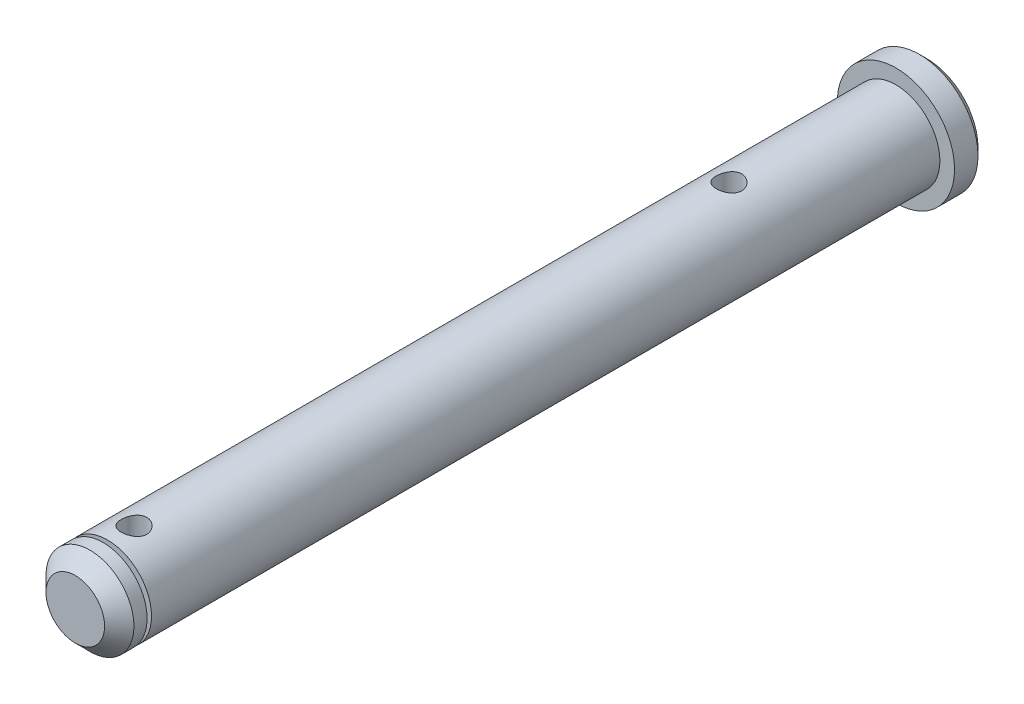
SolidWorks part; units mm, degrees
ref_plane "正面" through (0, 0, 0) normal (0, 0, 1) x (1, 0, 0)
ref_plane "平面" through (0, 0, 0) normal (0, 1, 0) x (1, 0, 0)
ref_plane "右側面" through (0, 0, 0) normal (1, 0, 0) x (0, 0, -1)
sketch "ｽｹｯﾁ1" plane through (0, 0, 0) normal (0, 0, 1) x (1, 0, 0)
  circle A0 centre (0, 0) radius 4
  dimension "D1" = 8
extrude "ﾎﾞｽ - 押し出し1" add sketch "ｽｹｯﾁ1" along normal blind 2.1
sketch "ｽｹｯﾁ2" plane through (0, 0, 0) normal (0, 0, -1) x (-1, 0, 0)
  circle A0 centre (0, 0) radius 3
  dimension "D1" = 6
extrude "ﾎﾞｽ - 押し出し2" add sketch "ｽｹｯﾁ2" against normal blind 58.1
hole_wizard "Ø1.75 (1.75) 直径の穴1" positions "3Dｽｹｯﾁ1" profile "ｽｹｯﾁ3" hole size "Ø1.75" standard "JIS"
sketch3d "3Dｽｹｯﾁ1"
  line L0 (0, 0, 0) -> (0, 3, 0) construction
  line L2 (0, 3, 0) -> (0, 3, 58.1) construction
  circle A0 centre (0, 0, 58.1) radius 3 construction
  point P0 (0, 3, 13.5)
  point P2 (0, 3, 54.1)
  point P20 (0, 0, 55.1)
  dimension "D1" = 13.5
  dimension "D2" = 4
sketch "ｽｹｯﾁ3" plane through (0, 3, 13.5) normal (1, 0, 0) x (0, 0, 1)
  line L0 (0, 0) -> (0, 7)
  line L1 (0, 7) -> (0.875, 7)
  line L2 (0.875, 7) -> (0.875, 0)
  line L5 (0.875, 0) -> (0, 0)
  line L11 (0, -6.35) -> (0, 107.95) construction
  dimension "通し穴の直径" = 1.75
  dimension "通し穴の深さ" = 7
chamfer "面取り1" distance 0.5 angle 45 1 edges at (4, 0, 0)
chamfer "面取り2" distance 1 angle 45 1 edges at (-3, 0, 58.1)
sketch "ｽｹｯﾁ4" plane through (0, 0, 0) normal (0, 1, 0) x (1, 0, 0)
  line L0 (-3, -2.1) -> (-3, -57.1) construction
  line L1 (-3, -55.9) -> (-2.5, -55.9)
  line L2 (-3, -55.9) -> (-3, -56.2)
  line L3 (-3, -56.2) -> (-2.5, -56.2)
  line L4 (-2.5, -55.9) -> (-2.5, -56.2)
  line L6 (-2, -58.1) -> (2, -58.1) construction
  dimension "D1" = 0.3
  dimension "D2" = 0.5
  dimension "D3" = 1.9
revolve "ｶｯﾄ - 回転1" cut sketch "ｽｹｯﾁ4" angle 360 about axis through (0, 0, 58.1) along (0, 0, -1)
